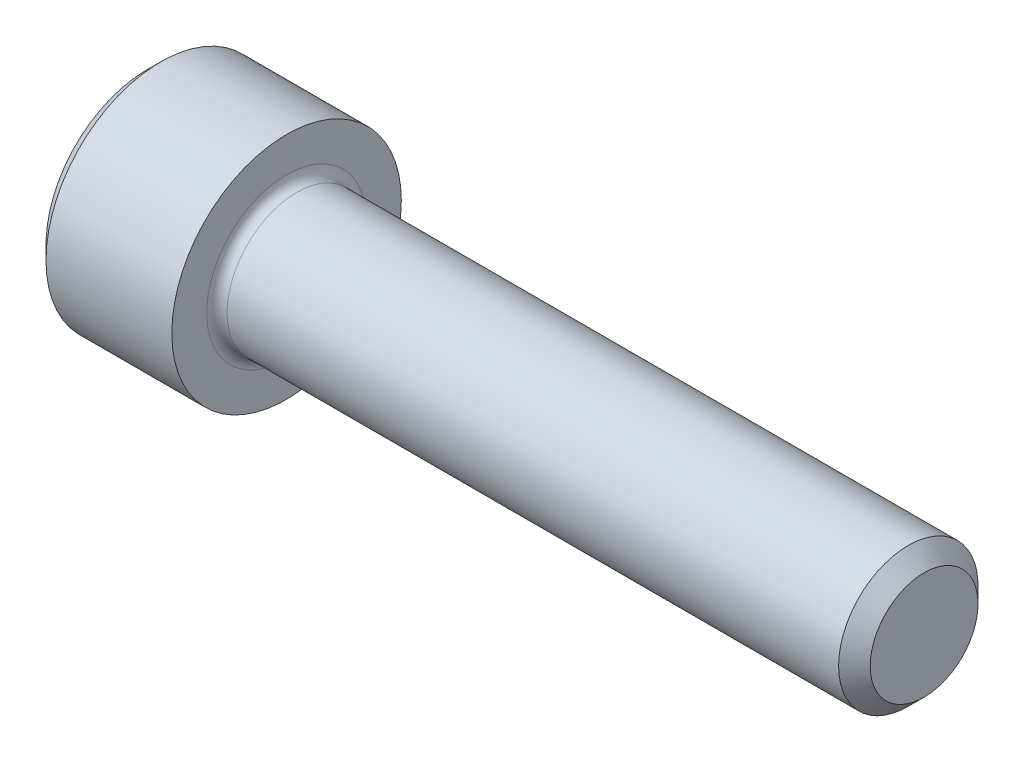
SolidWorks part; units mm, degrees
revolve "Base-Revolve" add sketch "BodySke"
sketch "BodySke" plane through (0, 0, 0) normal (0, 0, 1) x (1, 0, 0)
  line L0 (0, 0) -> (0, 3.0226)
  line L1 (0.4064, 3.429) -> (4.1656, 3.429)
  line L2 (4.1656, 3.429) -> (4.1656, 2.0828)
  line L3 (4.1656, 2.0828) -> (22.7432, 2.0828)
  line L4 (23.2156, 1.6104) -> (23.2156, 0)
  line L5 (23.2156, 0) -> (0, 0)
  line L6 (-31.75, 0) -> (127, 0) construction
  line L7 (0, 3.0226) -> (0.4064, 3.429)
  line L8 (23.2156, 1.6104) -> (22.7432, 2.0828)
  line L9 (0, -3.0226) -> (0.4064, -3.429) construction
  line L10 (23.2156, -1.6104) -> (22.7432, -2.0828) construction
  line L11 (4.9581, 9.525) -> (4.9581, 3.175) construction
  line L12 (4.1656, 9.525) -> (4.1656, 3.175) construction
  line L13 (-14.8844, 9.525) -> (-14.8844, 3.175) construction
  dimension "Diameter" = 4.1656
  dimension "Head_ht" = 4.1656
  dimension "Length" = 19.05
  dimension "Body_ch_ang" = 45
  dimension "Head_dia" = 6.858
  dimension "Head_ch_ang" = 45
  dimension "Head_side_ht" = 3.7592
  dimension "Minor_dia" = 3.2207
  dimension "Advance" = 0.7925
  dimension "Thread_nom" = 19.05
  dimension "Thread_length" = 38.1
fillet "Fillet1" radius 0.3048 1 edges at (4.1656, 0, 2.0828)
ref_plane "Plane1" through (0, 0, 0) normal (0, 0, 1) x (1, 0, 0)
ref_plane "Plane2" through (0, 0, 0) normal (0, 1, 0) x (1, 0, 0)
ref_plane "Plane3" through (0, 0, 0) normal (1, 0, 0) x (0, 0, -1)
sketch "Sketch2" plane through (0, 0, 0) normal (0, 0, 1) x (1, 0, 0)
  line L0 (0, 1.778) -> (1.9558, 1.778)
  line L1 (1.9558, 1.778) -> (2.9823, 0)
  line L2 (-31.75, 0) -> (127, 0) construction
  line L3 (2.9823, 0) -> (0, 0)
  line L4 (0, 0) -> (0, 1.778)
  line L5 (0, 3.0226) -> (0, -3.0226) construction
  line L6 (0, 0) -> (47.625, 0) construction
  line L7 (4.1656, -3.429) -> (4.1656, 3.429) construction
revolve "Hex-PreBroach" cut sketch "Sketch2" angle 360 about L6
sketch "Sketch3" plane through (0, 0, 0) normal (-1, 0, 0) x (0, 0.5, 0.866)
  line L0 (1.0265, 1.778) -> (-1.0265, 1.778)
  line L1 (-1.0265, 1.778) -> (-2.0531, 0)
  line L2 (1.0265, 1.778) -> (2.0531, 0)
  line L3 (1.0265, -1.778) -> (2.0531, 0)
  line L4 (1.0265, -1.778) -> (-1.0265, -1.778)
  line L5 (-1.0265, -1.778) -> (-2.0531, 0)
extrude "Hex" cut sketch "Sketch3" against normal blind 1.9558
sketch "Sketch4" plane through (0, 0, 0) normal (-1, 0, 0) x (0, 0, 1)
  line L0 (0, 0) -> (2.1971, 0)
  line L1 (0, 0) -> (6.1484, 3.5498) construction
  line L2 (0, 0) -> (1.0985, 1.9027)
  line L3 (1.8302, 0.5287) -> (2.0897, 0.6786)
  line L4 (1.373, 1.3206) -> (1.6325, 1.4704)
  arc A0 (1.8302, 0.5287) -> (1.373, 1.3206) centre (0, 0) ccw
  arc A1 (2.1971, 0) -> (2.0897, 0.6786) centre (0, 0) ccw
  arc A2 (1.0985, 1.9027) -> (1.6325, 1.4704) centre (0, 0) cw
extrude "Spline" [suppressed] cut sketch "Sketch4" against normal blind 1.9558
pattern_circular "CirPattern1" [suppressed] count 6 every 60
sketch "Sketch5" plane through (0, 0, 0) normal (0, 0, 1) x (1, 0, 0)
  line L0 (-31.75, 0) -> (127, 0) construction
  line L2 (0, 3.0226) -> (0, -3.0226) construction
  circle A0 centre (1.524, 0) radius 0.5906
  dimension "Drilled_hole_dia" = 1.1811
  dimension "Drilled_hole_loc" = 1.524
extrude "Hole" [suppressed] cut sketch "Sketch5" against normal through all and the other way through all
pattern_circular "Drilled-4" [suppressed] count 2 every 60
pattern_circular "Drilled-6" [suppressed] count 3 every 60
sketch "ThdSchSke" plane through (0, 0, 0) normal (0, 0, 1) x (1, 0, 0)
  line L0 (4.9581, -1.6104) -> (4.6273, -2.0828)
  line L1 (4.9581, -1.6104) -> (5.2889, -2.0828)
  line L2 (5.2889, -2.0828) -> (5.2889, -2.6035)
  line L3 (-3.175, 0) -> (5.1513, 0) construction
  line L5 (5.2889, -2.6035) -> (4.6273, -2.6035)
  line L6 (4.6273, -2.6035) -> (4.6273, -2.0828)
  line L7 (0, 3.0226) -> (0, -3.0226) construction
revolve "ThreadSchematic" [suppressed] cut sketch "ThdSchSke" angle 360 about L3
pattern_linear "ThdSchPat" [suppressed]
equation "\"D2@Sketch3\" = \"Hex_size@Sketch3\" / 2"
equation "\"D1@Sketch3\" = \"Hex_size@Sketch3\" / 2"
equation "\"D1@Sketch2\" = \"Hex_size@Sketch3\" / 2"
equation "\"D3@Sketch4\" = \"Spline_p_dim@Sketch4\" / 2"
equation "\"Thread_minor@ThreadCosmetic\"  =  \"Minor_dia@BodySke\""
equation "\"D2@CirPattern1\" = 360 / \"Num_teeth@CirPattern1\""
equation "\"Wall_thickness@Sketch2\" = \"Head_ht@BodySke\" - \"Key_eng@Hex\""
equation "\"Thread_length@ThreadCosmetic\" = ((sgn( (\"Length@BodySke\" - \"Advance@BodySke\" ) - \"Thread_nom@BodySke\" )-1)*( (\"Length@BodySke\" - \"Advance@BodySke\" ) - \"Thread_nom@BodySke\" ))/-2+ \"Thread_nom@BodySke\""
equation "\"Thread_minor@ThdSchSke\" = \"Minor_dia@BodySke\""
equation "\"Diameter@ThdSchSke\" = \"Diameter@BodySke\""
equation "\"Overcut@ThdSchSke\" = \"Diameter@BodySke\" * 1.25"
equation "\"Start@ThdSchSke\" = \"Head_ht@BodySke\" + \"Length@BodySke\" - \"Thread_length@ThreadCosmetic\"  '---Non-countersunk---"
equation "\"Num_threads@ThdSchPat\" = int( \"Thread_length@ThreadCosmetic\" / \"Advance@BodySke\" + 0.999 )  + 1"
equation "\"Advance@ThdSchPat\" = \"Thread_length@ThreadCosmetic\" /  (\"Num_threads@ThdSchPat\" - 1) 'relax it"
equation "\"Num_threads@ThdSchPat\" = \"Num_threads@ThdSchPat\" - sgn( \"Num_threads@ThdSchPat\" - 1) '---chamfered tips only---"
